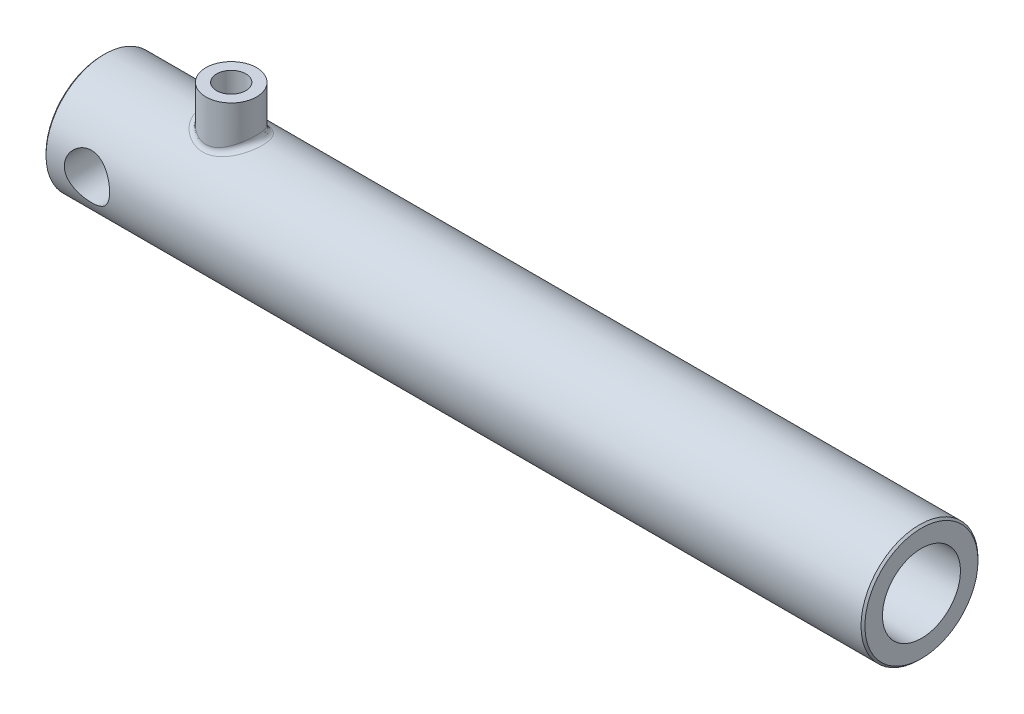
SolidWorks part; units mm, degrees
ref_plane "Plan de face" through (0, 0, 0) normal (0, 0, 1) x (1, 0, 0)
ref_plane "Plan de dessus" through (0, 0, 0) normal (0, 1, 0) x (1, 0, 0)
ref_plane "Plan de droite" through (0, 0, 0) normal (1, 0, 0) x (0, 0, -1)
ref_plane "Plan1" through (0, 0, 0) normal (0, 0, -1) x (-1, 0, 0)
sketch "Esquisse1" plane through (0, 0, 0) normal (0, 0, -1) x (-1, 0, 0)
  line L0 (-320, 30) -> (-320, 0)
  line L1 (-320, 0) -> (100, 0)
  line L2 (100, 0) -> (100, 30)
  line L3 (100, 30) -> (-320, 30)
  line L4 (-320, 0) -> (100, 0) construction
  dimension "D1" = 420
  dimension "D2" = 30
revolve "Révolution1" add sketch "Esquisse1" angle 360 about L4
ref_plane "Plan2" through (66, 0, 0) normal (1, 0, 0) x (0, 0, -1)
ref_plane "Plan3" through (-34, 0, 0) normal (1, 0, 0) x (0, 0, -1)
ref_plane "Plan4" through (-78, 0, 0) normal (1, 0, 0) x (0, 0, -1)
sketch "Esquisse2" plane through (-34, 0, 0) normal (1, 0, 0) x (0, 0, -1)
  line L0 (13, 50) -> (0, 50)
  line L1 (0, 50) -> (0, 27.037)
  line L2 (0, 27.037) -> (13, 27.037)
  line L3 (13, 27.037) -> (13, 50)
  line L4 (0, 50) -> (0, 27.037) construction
revolve "Révolution2" add sketch "Esquisse2" angle 360 about L4
hole_wizard "Diamètre du perçage Ø6.8 (6.8)1" positions "Esquisse5" profile "Esquisse4" hole size "Ø6.8" standard "Ansi Metric"
sketch "Esquisse5" plane through (-100, 0, 0) normal (-1, 0, 0) x (0, 0, 1)
  point P0 (0, 0)
sketch "Esquisse4" plane through (-100, 0, 0) normal (0, 1, 0) x (0, 0, 1)
  line L0 (0, 0) -> (0, 420)
  line L1 (0, 420) -> (3.4, 420)
  line L2 (3.4, 420) -> (3.4, 0)
  line L5 (3.4, 0) -> (0, 0)
  line L11 (0, -6.35) -> (0, 107.95) construction
  dimension "Diamètre du perçage jusqu'au prochain" = 6.8
  dimension "Profondeur du perçage jusqu'au prochain" = 420
hole_wizard "Chambrage pour vis à tête hexagonale M481" positions "Esquisse7" profile "Esquisse6" counterbore size "M48" standard "Ansi Metric"
sketch "Esquisse7" plane through (320, 0, 0) normal (1, 0, 0) x (0, 0, -1)
  point P0 (0, 0)
sketch "Esquisse6" plane through (320, 0, 0) normal (0, 1, 0) x (0, 0, -1)
  line L0 (0, 0) -> (0, 372)
  line L1 (0, 372) -> (25, 372)
  line L2 (25, 372) -> (25, 59)
  line L3 (25, 59) -> (20, 59)
  line L4 (20, 59) -> (20, 0)
  line L5 (20, 0) -> (0, 0)
  line L10 (0, 372) -> (-25, 372) construction
  line L11 (0, -6.35) -> (0, 107.95) construction
  dimension "Diamètre du perçage" = 50
  dimension "Profondeur du perçage" = 372
  dimension "Diamètre du chambrage" = 40
  dimension "Profondeur du chambrage" = 59
  dimension "Angle de pointe" = 180
chamfer "Chanfrein1" distance 1 angle 45 2 edges at (320, 0, 30) (-100, 0, 30)
fillet "Congé1" radius 3 1 edges at (-32.2548, 27.0933, 12.8823)
sketch "Esquisse10" plane through (-78, 0, 0) normal (1, 0, 0) x (0, 0, -1)
  line L0 (-36.3757, 0) -> (44.2971, 0) construction
  line L2 (-30, 0) -> (-30, 11.625)
  line L3 (-30, 11.625) -> (30, 11.625)
  line L4 (30, 0) -> (30, 11.625)
  line L5 (-30, 0) -> (30, 0)
  dimension "D1" = 30
  dimension "D2" = 30
  dimension "D4" = 11.625
revolve "Enlèvement de matière-Révolution3" cut sketch "Esquisse10" angle 360 about L0
sketch "Esquisse11" plane through (0, 50, 0) normal (0, 1, 0) x (1, 0, 0)
  line L0 (-34, -33) -> (-34, 33) construction
  circle A0 centre (-34, 0) radius 7.5
  dimension "D1" = 15
extrude "Enlèv. mat.-Extru.1" cut sketch "Esquisse11" against normal up to next
